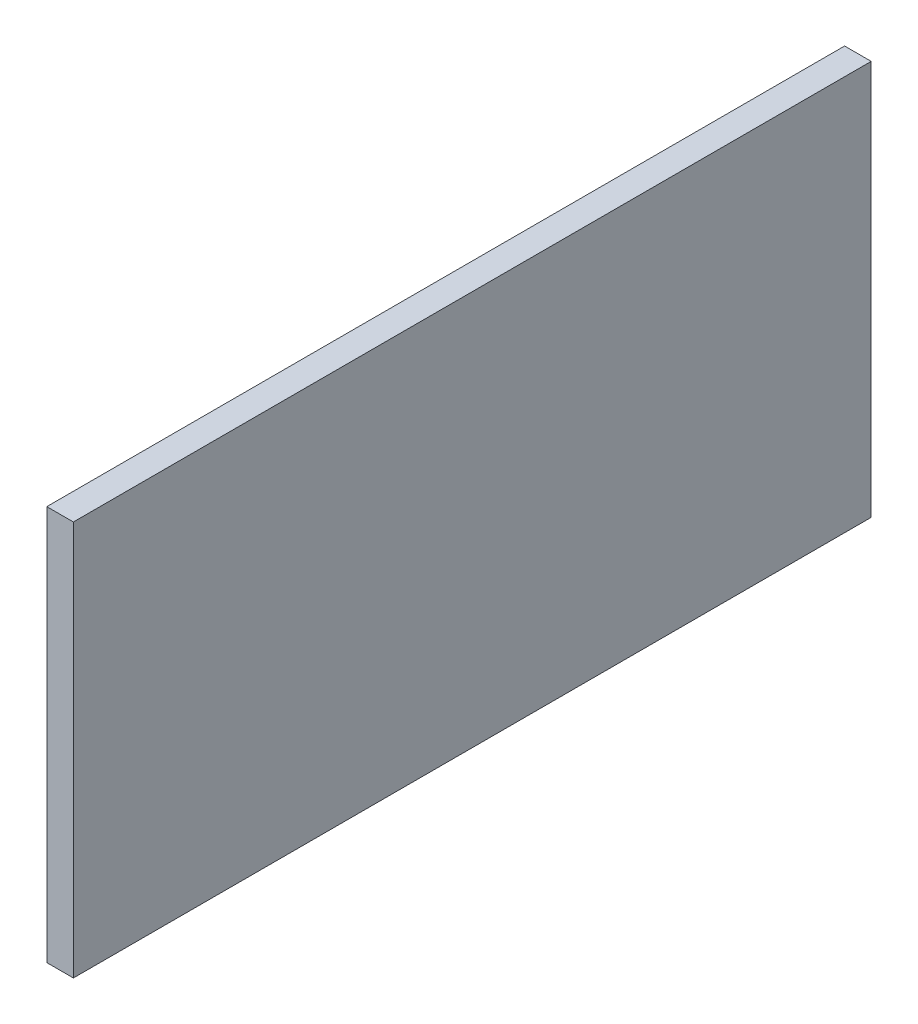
SolidWorks part; units mm, degrees
ref_plane "Alzado" through (0, 0, 0) normal (0, 0, 1) x (1, 0, 0)
ref_plane "Planta" through (0, 0, 0) normal (0, 1, 0) x (1, 0, 0)
ref_plane "Vista lateral" through (0, 0, 0) normal (1, 0, 0) x (0, 0, -1)
sketch "Croquis1" plane through (0, 0, 0) normal (1, 0, 0) x (0, 0, -1)
  line L1 (0, 0) -> (1200, 0)
  line L2 (0, 0) -> (0, 594)
  line L3 (0, 594) -> (1200, 594)
  line L4 (1200, 0) -> (1200, 594)
  dimension "D1" = 594
  dimension "D2" = 1200
extrude "Saliente-Extruir1" add sketch "Croquis1" along normal blind 40
